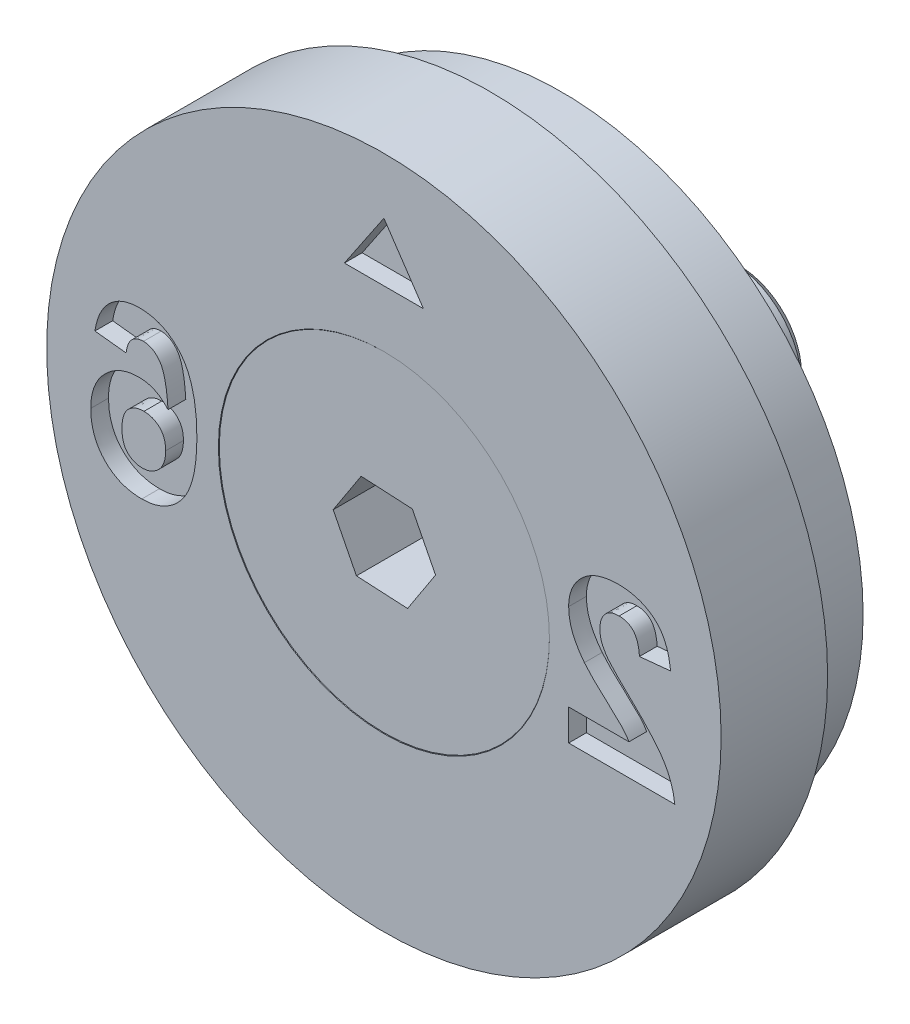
SolidWorks part; units mm, degrees
other "<M4 X .7 FHCS>-<Imported1>"
ref_plane "Front Plane" through (0, 0, 0) normal (0, 0, 1) x (1, 0, 0)
ref_plane "Top Plane" through (0, 0, 0) normal (0, 1, 0) x (1, 0, 0)
ref_plane "Right Plane" through (0, 0, 0) normal (1, 0, 0) x (0, 0, -1)
imported_body "Imported1"
sketch "Sketch1" plane through (0, 0, 0) normal (0, 0, 1) x (1, 0, 0)
  text T0 "2       6" font "Arial" height 4.572
  dimension "D1" = 2.286
extrude "Cut-Extrude1" cut sketch "Sketch1" against normal blind 0.5
inserted part "M4 X .7 FHCS"
move or copy body "Body-Move/Copy2" placed by mates yes
